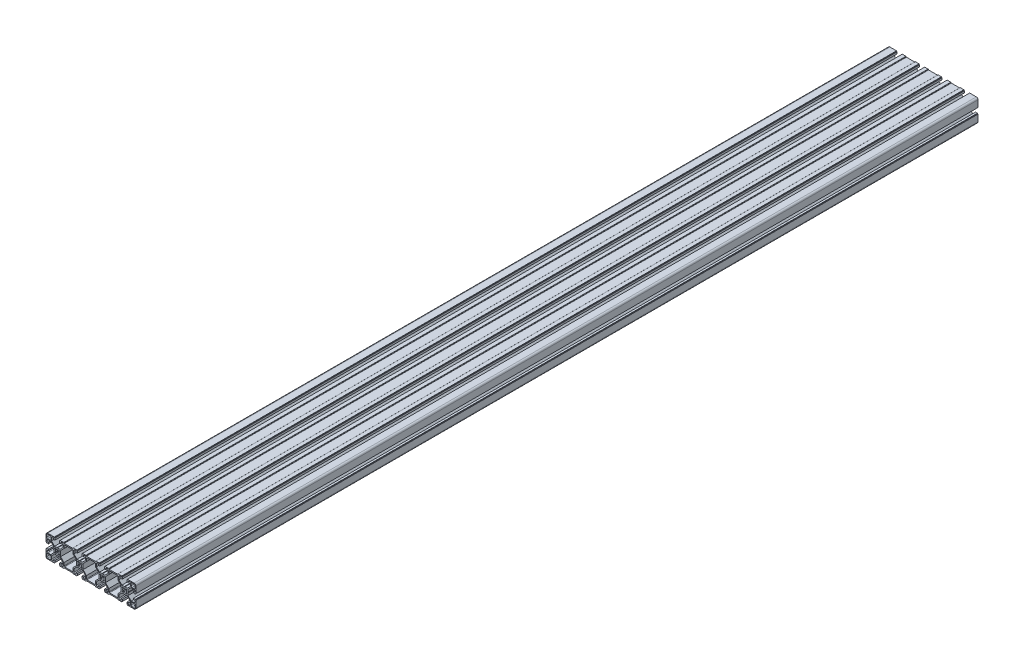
SolidWorks part; units mm, degrees
ref_plane "Спереди" through (0, 0, 0) normal (0, 0, 1) x (1, 0, 0)
ref_plane "Сверху" through (0, 0, 0) normal (0, 1, 0) x (1, 0, 0)
ref_plane "Справа" through (0, 0, 0) normal (1, 0, 0) x (0, 0, -1)
sketch "Эскиз1" plane through (0, 0, 0) normal (0, 0, 1) x (1, 0, 0)
  line L0 (-46.462, 18.2077) -> (-46.462, 18.1877)
  line L1 (-53.4116, 18.6977) -> (-46.952, 18.6977)
  line L2 (-53.4116, 18.6977) -> (-53.4116, 17.6977)
  line L3 (-53.4116, 17.6977) -> (-54.4116, 17.6977)
  line L4 (-54.4116, 17.6977) -> (-54.4116, 14.2977)
  line L5 (-54.4116, 14.2977) -> (-52.1116, 14.2977)
  line L6 (-52.1116, 14.2977) -> (-52.1116, 15.4977)
  line L7 (-50.6116, 16.9977) -> (-49.763, 16.9977)
  line L8 (-48.263, 15.4977) -> (-48.263, 10.2315)
  line L9 (-48.263, 10.2315) -> (-53.7946, 4.6937)
  line L10 (-58.0239, 4.6937) -> (-53.7946, 4.6937)
  line L11 (-58.5194, 4.1983) -> (-58.0239, 4.6937)
  line L12 (-58.5194, 4.1983) -> (-59.0148, 4.6937)
  line L13 (-63.2441, 4.6937) -> (-59.0148, 4.6937)
  line L14 (-68.7597, 10.2122) -> (-63.2441, 4.6937)
  line L15 (-68.7597, 15.4977) -> (-68.7597, 10.2122)
  line L16 (-66.4116, 16.9977) -> (-67.2597, 16.9977)
  line L17 (-64.9116, 14.2977) -> (-64.9116, 15.4977)
  line L18 (-62.6116, 14.2977) -> (-64.9116, 14.2977)
  line L19 (-62.6116, 17.6977) -> (-62.6116, 14.2977)
  line L20 (-63.6116, 17.6977) -> (-62.6116, 17.6977)
  line L21 (-63.6116, 18.6977) -> (-63.6116, 17.6977)
  line L22 (-75.5116, 18.6977) -> (-63.6116, 18.6977)
  line L23 (-78.5116, 15.6977) -> (-78.5116, 3.7977)
  line L24 (-78.5116, 3.7977) -> (-77.5116, 3.7977)
  line L25 (-77.5116, 3.7977) -> (-77.5116, 2.7977)
  line L26 (-77.5116, 2.7977) -> (-74.1116, 2.7977)
  line L27 (-74.1116, 2.7977) -> (-74.1116, 5.0903)
  line L28 (-74.1116, 5.0903) -> (-75.3116, 5.0903)
  line L29 (-76.8116, 6.5903) -> (-76.8116, 7.4383)
  line L30 (-75.3116, 8.9383) -> (-70.0385, 8.9383)
  line L31 (-70.0385, 8.9383) -> (-64.5116, 3.4121)
  line L32 (-64.5116, 3.4121) -> (-64.5116, -0.8055)
  line L33 (-64.0107, -1.3064) -> (-64.5116, -0.8055)
  line L34 (-64.0107, -1.3064) -> (-64.5116, -1.8073)
  line L35 (-64.5116, -1.8073) -> (-64.5116, -6.0248)
  line L36 (-64.5116, -6.0248) -> (-70.0391, -11.5523)
  line L37 (-75.3116, -11.5523) -> (-70.0391, -11.5523)
  line L38 (-76.8116, -9.2023) -> (-76.8116, -10.0523)
  line L39 (-74.1116, -7.7023) -> (-75.3116, -7.7023)
  line L40 (-74.1116, -5.4023) -> (-74.1116, -7.7023)
  line L41 (-77.5116, -5.4023) -> (-74.1116, -5.4023)
  line L42 (-77.5116, -6.4023) -> (-77.5116, -5.4023)
  line L43 (-78.5116, -6.4023) -> (-77.5116, -6.4023)
  line L44 (-78.5116, -6.4023) -> (-78.5116, -18.3023)
  line L45 (-63.6116, -21.3023) -> (-75.5116, -21.3023)
  line L46 (-63.6116, -21.3023) -> (-63.6116, -20.3023)
  line L47 (-63.6116, -20.3023) -> (-62.6116, -20.3023)
  line L48 (-62.6116, -20.3023) -> (-62.6116, -16.9023)
  line L49 (-62.6116, -16.9023) -> (-64.9116, -16.9023)
  line L50 (-64.9116, -16.9023) -> (-64.9116, -18.1023)
  line L51 (-66.4116, -19.6023) -> (-67.2616, -19.6023)
  line L52 (-68.7616, -18.1023) -> (-68.7616, -12.799)
  line L53 (-63.2494, -7.3063) -> (-68.7616, -12.799)
  line L54 (-63.2494, -7.3063) -> (-59.0181, -7.3063)
  line L55 (-58.5195, -6.8077) -> (-59.0181, -7.3063)
  line L56 (-58.5195, -6.8077) -> (-58.021, -7.3063)
  line L57 (-58.021, -7.3063) -> (-53.7897, -7.3063)
  line L58 (-53.7897, -7.3063) -> (-48.2666, -12.8248)
  line L59 (-48.2666, -18.1023) -> (-48.2666, -12.8248)
  line L60 (-50.6116, -19.6023) -> (-49.7666, -19.6023)
  line L61 (-52.1116, -16.9023) -> (-52.1116, -18.1023)
  line L62 (-54.4116, -16.9023) -> (-52.1116, -16.9023)
  line L63 (-54.4116, -20.3023) -> (-54.4116, -16.9023)
  line L64 (-53.4116, -20.3023) -> (-54.4116, -20.3023)
  line L65 (-53.4116, -21.3023) -> (-53.4116, -20.3023)
  line L66 (-53.4116, -21.3023) -> (-46.9623, -21.3023)
  line L67 (-46.4723, -20.8123) -> (-46.4723, -20.7923)
  line L68 (-45.9823, -20.3023) -> (-31.0574, -20.3023)
  line L69 (-30.5674, -20.8123) -> (-30.5674, -20.7923)
  line L70 (-30.0774, -21.3023) -> (-23.6116, -21.3023)
  line L71 (-23.6116, -21.3023) -> (-23.6116, -20.3023)
  line L72 (-23.6116, -20.3023) -> (-22.6116, -20.3023)
  line L73 (-22.6116, -20.3023) -> (-22.6116, -16.9023)
  line L74 (-22.6116, -16.9023) -> (-24.9116, -16.9023)
  line L75 (-24.9116, -16.9023) -> (-24.9116, -18.1023)
  line L76 (-26.4116, -19.6023) -> (-27.2616, -19.6023)
  line L77 (-28.7616, -18.1023) -> (-28.7616, -12.799)
  line L78 (-23.2494, -7.3063) -> (-28.7616, -12.799)
  line L79 (-23.2494, -7.3063) -> (-19.0181, -7.3063)
  line L80 (-18.5195, -6.8077) -> (-19.0181, -7.3063)
  line L81 (-18.5195, -6.8077) -> (-18.021, -7.3063)
  line L82 (-18.021, -7.3063) -> (-13.7897, -7.3063)
  line L83 (-13.7897, -7.3063) -> (-8.2666, -12.8248)
  line L84 (-8.2666, -18.1023) -> (-8.2666, -12.8248)
  line L85 (-10.6116, -19.6023) -> (-9.7666, -19.6023)
  line L86 (-12.1116, -16.9023) -> (-12.1116, -18.1023)
  line L87 (-14.4116, -16.9023) -> (-12.1116, -16.9023)
  line L88 (-14.4116, -20.3023) -> (-14.4116, -16.9023)
  line L89 (-13.4116, -20.3023) -> (-14.4116, -20.3023)
  line L90 (-13.4116, -21.3023) -> (-13.4116, -20.3023)
  line L91 (-7.4866, -21.3023) -> (-13.4116, -21.3023)
  line L92 (-6.9966, -20.8123) -> (-6.9966, -20.7923)
  line L93 (9.4784, -20.3023) -> (-6.5066, -20.3023)
  line L94 (9.9684, -20.8123) -> (9.9684, -20.7923)
  line L95 (16.3884, -21.3023) -> (10.4584, -21.3023)
  line L96 (16.3884, -21.3023) -> (16.3884, -20.3023)
  line L97 (16.3884, -20.3023) -> (17.3884, -20.3023)
  line L98 (17.3884, -20.3023) -> (17.3884, -16.9023)
  line L99 (17.3884, -16.9023) -> (15.0884, -16.9023)
  line L100 (15.0884, -16.9023) -> (15.0884, -18.1023)
  line L101 (13.5884, -19.6023) -> (12.7384, -19.6023)
  line L102 (11.2384, -18.1023) -> (11.2384, -12.799)
  line L103 (16.7506, -7.3063) -> (11.2384, -12.799)
  line L104 (16.7506, -7.3063) -> (20.9819, -7.3063)
  line L105 (21.4805, -6.8077) -> (20.9819, -7.3063)
  line L106 (21.4805, -6.8077) -> (21.979, -7.3063)
  line L107 (21.979, -7.3063) -> (26.2103, -7.3063)
  line L108 (26.2103, -7.3063) -> (31.7334, -12.8248)
  line L109 (31.7334, -18.1023) -> (31.7334, -12.8248)
  line L110 (29.3884, -19.6023) -> (30.2334, -19.6023)
  line L111 (27.8884, -16.9023) -> (27.8884, -18.1023)
  line L112 (25.5884, -16.9023) -> (27.8884, -16.9023)
  line L113 (25.5884, -20.3023) -> (25.5884, -16.9023)
  line L114 (26.5884, -20.3023) -> (25.5884, -20.3023)
  line L115 (26.5884, -21.3023) -> (26.5884, -20.3023)
  line L116 (26.5884, -21.3023) -> (33.0377, -21.3023)
  line L117 (33.5277, -20.8123) -> (33.5277, -20.7923)
  line L118 (48.9426, -20.3023) -> (34.0177, -20.3023)
  line L119 (49.4326, -20.8123) -> (49.4326, -20.7923)
  line L120 (49.9226, -21.3023) -> (56.3884, -21.3023)
  line L121 (56.3884, -21.3023) -> (56.3884, -20.3023)
  line L122 (56.3884, -20.3023) -> (57.3884, -20.3023)
  line L123 (57.3884, -20.3023) -> (57.3884, -16.9023)
  line L124 (57.3884, -16.9023) -> (55.0884, -16.9023)
  line L125 (55.0884, -16.9023) -> (55.0884, -18.1023)
  line L126 (53.5884, -19.6023) -> (52.7384, -19.6023)
  line L127 (51.2384, -18.1023) -> (51.2384, -12.799)
  line L128 (56.7506, -7.3063) -> (51.2384, -12.799)
  line L129 (56.7506, -7.3063) -> (60.9819, -7.3063)
  line L130 (61.4805, -6.8077) -> (60.9819, -7.3063)
  line L131 (61.4805, -6.8077) -> (61.979, -7.3063)
  line L132 (61.979, -7.3063) -> (66.2103, -7.3063)
  line L133 (66.2103, -7.3063) -> (71.7334, -12.8248)
  line L134 (71.7334, -18.1023) -> (71.7334, -12.8248)
  line L135 (69.3884, -19.6023) -> (70.2334, -19.6023)
  line L136 (67.8884, -16.9023) -> (67.8884, -18.1023)
  line L137 (65.5884, -16.9023) -> (67.8884, -16.9023)
  line L138 (65.5884, -20.3023) -> (65.5884, -16.9023)
  line L139 (66.5884, -20.3023) -> (65.5884, -20.3023)
  line L140 (66.5884, -21.3023) -> (66.5884, -20.3023)
  line L141 (78.4884, -21.3023) -> (66.5884, -21.3023)
  line L142 (81.4884, -6.4023) -> (81.4884, -18.3023)
  line L143 (81.4884, -6.4023) -> (80.4831, -6.4023)
  line L144 (80.4831, -6.4023) -> (80.4831, -5.4023)
  line L145 (80.4831, -5.4023) -> (77.0831, -5.4023)
  line L146 (77.0831, -5.4023) -> (77.0831, -7.7023)
  line L147 (77.0831, -7.7023) -> (78.2831, -7.7023)
  line L148 (79.7831, -9.2023) -> (79.7831, -10.0582)
  line L149 (78.2831, -11.5582) -> (73.0067, -11.5582)
  line L150 (67.4831, -6.0343) -> (73.0067, -11.5582)
  line L151 (67.4831, -1.7964) -> (67.4831, -6.0343)
  line L152 (66.9919, -1.3052) -> (67.4831, -1.7964)
  line L153 (66.9919, -1.3052) -> (67.4831, -0.814)
  line L154 (67.4831, 3.4238) -> (67.4831, -0.814)
  line L155 (73.0056, 8.9438) -> (67.4831, 3.4238)
  line L156 (78.2831, 8.9438) -> (73.0056, 8.9438)
  line L157 (79.7831, 6.5998) -> (79.7831, 7.4438)
  line L158 (77.0831, 5.0998) -> (78.2831, 5.0998)
  line L159 (77.0831, 2.7998) -> (77.0831, 5.0998)
  line L160 (80.4831, 2.7998) -> (77.0831, 2.7998)
  line L161 (80.4831, 3.7998) -> (80.4831, 2.7998)
  line L162 (81.4884, 3.7998) -> (80.4831, 3.7998)
  line L163 (81.4884, 15.6977) -> (81.4884, 3.7998)
  line L164 (66.5884, 18.6977) -> (78.4884, 18.6977)
  line L165 (66.5884, 18.6977) -> (66.5884, 17.6977)
  line L166 (66.5884, 17.6977) -> (65.5884, 17.6977)
  line L167 (65.5884, 17.6977) -> (65.5884, 14.2977)
  line L168 (65.5884, 14.2977) -> (67.8884, 14.2977)
  line L169 (67.8884, 14.2977) -> (67.8884, 15.4977)
  line L170 (69.3884, 16.9977) -> (70.237, 16.9977)
  line L171 (71.737, 15.4977) -> (71.737, 10.2315)
  line L172 (71.737, 10.2315) -> (66.2054, 4.6937)
  line L173 (61.9761, 4.6937) -> (66.2054, 4.6937)
  line L174 (61.4806, 4.1983) -> (61.9761, 4.6937)
  line L175 (61.4806, 4.1983) -> (60.9852, 4.6937)
  line L176 (56.7559, 4.6937) -> (60.9852, 4.6937)
  line L177 (51.2403, 10.2122) -> (56.7559, 4.6937)
  line L178 (51.2403, 15.4977) -> (51.2403, 10.2122)
  line L179 (53.5884, 16.9977) -> (52.7403, 16.9977)
  line L180 (55.0884, 14.2977) -> (55.0884, 15.4977)
  line L181 (57.3884, 14.2977) -> (55.0884, 14.2977)
  line L182 (57.3884, 17.6977) -> (57.3884, 14.2977)
  line L183 (56.3884, 17.6977) -> (57.3884, 17.6977)
  line L184 (56.3884, 18.6977) -> (56.3884, 17.6977)
  line L185 (49.9314, 18.6977) -> (56.3884, 18.6977)
  line L186 (49.4414, 18.2077) -> (49.4414, 18.1877)
  line L187 (48.9514, 17.6977) -> (34.028, 17.6977)
  line L188 (33.538, 18.2077) -> (33.538, 18.1877)
  line L189 (26.5884, 18.6977) -> (33.048, 18.6977)
  line L190 (26.5884, 18.6977) -> (26.5884, 17.6977)
  line L191 (26.5884, 17.6977) -> (25.5884, 17.6977)
  line L192 (25.5884, 17.6977) -> (25.5884, 14.2977)
  line L193 (25.5884, 14.2977) -> (27.8884, 14.2977)
  line L194 (27.8884, 14.2977) -> (27.8884, 15.4977)
  line L195 (29.3884, 16.9977) -> (30.237, 16.9977)
  line L196 (31.737, 15.4977) -> (31.737, 10.2315)
  line L197 (31.737, 10.2315) -> (26.2054, 4.6937)
  line L198 (21.9761, 4.6937) -> (26.2054, 4.6937)
  line L199 (21.4806, 4.1983) -> (21.9761, 4.6937)
  line L200 (21.4806, 4.1983) -> (20.9852, 4.6937)
  line L201 (16.7559, 4.6937) -> (20.9852, 4.6937)
  line L202 (11.2403, 10.2122) -> (16.7559, 4.6937)
  line L203 (11.2403, 15.4977) -> (11.2403, 10.2122)
  line L204 (13.5884, 16.9977) -> (12.7403, 16.9977)
  line L205 (15.0884, 14.2977) -> (15.0884, 15.4977)
  line L206 (17.3884, 14.2977) -> (15.0884, 14.2977)
  line L207 (17.3884, 17.6977) -> (17.3884, 14.2977)
  line L208 (16.3884, 17.6977) -> (17.3884, 17.6977)
  line L209 (16.3884, 18.6977) -> (16.3884, 17.6977)
  line L210 (16.3884, 18.6977) -> (10.4603, 18.6977)
  line L211 (9.9703, 18.2077) -> (9.9703, 18.1877)
  line L212 (9.4803, 17.6977) -> (-6.503, 17.6977)
  line L213 (-6.993, 18.2077) -> (-6.993, 18.1877)
  line L214 (-7.483, 18.6977) -> (-13.4116, 18.6977)
  line L215 (-13.4116, 18.6977) -> (-13.4116, 17.6977)
  line L216 (-13.4116, 17.6977) -> (-14.4116, 17.6977)
  line L217 (-14.4116, 17.6977) -> (-14.4116, 14.2977)
  line L218 (-14.4116, 14.2977) -> (-12.1116, 14.2977)
  line L219 (-12.1116, 14.2977) -> (-12.1116, 15.4977)
  line L220 (-10.6116, 16.9977) -> (-9.763, 16.9977)
  line L221 (-8.263, 15.4977) -> (-8.263, 10.2315)
  line L222 (-8.263, 10.2315) -> (-13.7946, 4.6937)
  line L223 (-18.0239, 4.6937) -> (-13.7946, 4.6937)
  line L224 (-18.5194, 4.1983) -> (-18.0239, 4.6937)
  line L225 (-18.5194, 4.1983) -> (-19.0148, 4.6937)
  line L226 (-23.2441, 4.6937) -> (-19.0148, 4.6937)
  line L227 (-28.7597, 10.2122) -> (-23.2441, 4.6937)
  line L228 (-28.7597, 15.4977) -> (-28.7597, 10.2122)
  line L229 (-26.4116, 16.9977) -> (-27.2597, 16.9977)
  line L230 (-24.9116, 14.2977) -> (-24.9116, 15.4977)
  line L231 (-22.6116, 14.2977) -> (-24.9116, 14.2977)
  line L232 (-22.6116, 17.6977) -> (-22.6116, 14.2977)
  line L233 (-23.6116, 17.6977) -> (-22.6116, 17.6977)
  line L234 (-23.6116, 18.6977) -> (-23.6116, 17.6977)
  line L235 (-30.0686, 18.6977) -> (-23.6116, 18.6977)
  line L236 (-30.5586, 18.2077) -> (-30.5586, 18.1877)
  line L237 (-31.0486, 17.6977) -> (-45.972, 17.6977)
  line L238 (-69.8551, 11.8457) -> (-69.8551, 15.6977)
  line L239 (-71.6551, 10.0457) -> (-75.507, 10.0457)
  line L240 (-77.307, 15.6977) -> (-77.307, 11.8457)
  line L241 (-75.507, 17.4977) -> (-71.6551, 17.4977)
  line L242 (74.641, -12.6582) -> (78.493, -12.6582)
  line L243 (80.293, -18.3023) -> (80.293, -14.4582)
  line L244 (78.493, -20.1023) -> (74.641, -20.1023)
  line L245 (72.841, -14.4582) -> (72.841, -18.3023)
  line L246 (78.493, 17.4977) -> (74.6449, 17.4977)
  line L247 (80.293, 15.6977) -> (80.293, 11.8418)
  line L248 (74.6449, 10.0418) -> (78.493, 10.0418)
  line L249 (72.8449, 11.8418) -> (72.8449, 15.6977)
  line L250 (8.4403, 15.6977) -> (-5.463, 15.6977)
  line L251 (9.4403, 9.4601) -> (9.4403, 14.6977)
  line L252 (15.4884, 3.4121) -> (9.4403, 9.4601)
  line L253 (15.4884, 3.4121) -> (15.4884, -6.0248)
  line L254 (15.4884, -6.0248) -> (9.4384, -12.0748)
  line L255 (9.4384, -17.3023) -> (9.4384, -12.0748)
  line L256 (8.4384, -18.3023) -> (-5.4666, -18.3023)
  line L257 (-6.4666, -12.0846) -> (-6.4666, -17.3023)
  line L258 (-12.5169, -6.0343) -> (-6.4666, -12.0846)
  line L259 (-12.5169, 3.4238) -> (-12.5169, -6.0343)
  line L260 (-12.5169, 3.4238) -> (-6.463, 9.4777)
  line L261 (-6.463, 14.6977) -> (-6.463, 9.4777)
  line L262 (34.538, 15.6977) -> (48.4414, 15.6977)
  line L263 (49.4414, 14.6977) -> (49.4414, 9.4241)
  line L264 (49.4414, 9.4241) -> (55.454, 3.4121)
  line L265 (55.454, 3.4121) -> (55.4531, -6.0248)
  line L266 (55.4531, -6.0248) -> (49.4326, -12.0453)
  line L267 (49.4326, -12.0453) -> (49.4326, -17.3023)
  line L268 (34.5277, -18.3023) -> (48.4326, -18.3023)
  line L269 (33.5277, -12.0792) -> (33.5277, -17.3023)
  line L270 (27.4831, -6.0343) -> (33.5277, -12.0792)
  line L271 (27.4831, 3.4238) -> (27.4831, -6.0343)
  line L272 (33.538, 9.4763) -> (27.4831, 3.4238)
  line L273 (33.538, 14.6977) -> (33.538, 9.4763)
  line L274 (25.5588, -4.665) -> (24.8517, -5.3721)
  line L275 (23.0837, -4.3112) -> (24.1446, -5.3721)
  line L276 (19.9022, -4.3112) -> (18.8413, -5.3721)
  line L277 (17.4271, -4.665) -> (18.1342, -5.3721)
  line L278 (18.488, -2.897) -> (17.4271, -3.9579)
  line L279 (17.4271, 1.3454) -> (18.488, 0.2845)
  line L280 (18.1342, 2.7596) -> (17.4271, 2.0525)
  line L281 (18.8413, 2.7596) -> (19.9022, 1.6987)
  line L282 (24.1446, 2.7596) -> (23.0837, 1.6987)
  line L283 (25.5588, 2.0525) -> (24.8517, 2.7596)
  line L284 (25.5588, 1.3454) -> (24.4979, 0.2845)
  line L285 (24.4979, -2.897) -> (25.5588, -3.9579)
  line L286 (-20.0978, -4.3112) -> (-21.1587, -5.3721)
  line L287 (-22.5729, -4.665) -> (-21.8658, -5.3721)
  line L288 (-21.512, -2.897) -> (-22.5729, -3.9579)
  line L289 (-22.5729, 1.3454) -> (-21.512, 0.2845)
  line L290 (-21.8658, 2.7596) -> (-22.5729, 2.0525)
  line L291 (-21.1587, 2.7596) -> (-20.0978, 1.6987)
  line L292 (-15.8554, 2.7596) -> (-16.9163, 1.6987)
  line L293 (-14.4412, 2.0525) -> (-15.1483, 2.7596)
  line L294 (-14.4412, 1.3454) -> (-15.5021, 0.2845)
  line L295 (-15.5021, -2.897) -> (-14.4412, -3.9579)
  line L296 (-15.1483, -5.3721) -> (-14.4412, -4.665)
  line L297 (-16.9163, -4.3112) -> (-15.8554, -5.3721)
  line L298 (-55.8554, 2.7596) -> (-56.9163, 1.6987)
  line L299 (-54.4412, 2.0525) -> (-55.1483, 2.7596)
  line L300 (-54.4412, 1.3454) -> (-55.5021, 0.2845)
  line L301 (-55.5021, -2.897) -> (-54.4412, -3.9579)
  line L302 (-55.1483, -5.3721) -> (-54.4412, -4.665)
  line L303 (-56.9163, -4.3112) -> (-55.8554, -5.3721)
  line L304 (-60.0978, -4.3112) -> (-61.1587, -5.3721)
  line L305 (-62.5729, -4.665) -> (-61.8658, -5.3721)
  line L306 (-61.512, -2.897) -> (-62.5729, -3.9579)
  line L307 (-62.5729, 1.3454) -> (-61.512, 0.2845)
  line L308 (-61.8658, 2.7596) -> (-62.5729, 2.0525)
  line L309 (-61.1587, 2.7596) -> (-60.0978, 1.6987)
  line L310 (64.8517, -5.3721) -> (65.5588, -4.665)
  line L311 (63.0837, -4.3112) -> (64.1446, -5.3721)
  line L312 (59.9022, -4.3112) -> (58.8413, -5.3721)
  line L313 (57.4271, -4.665) -> (58.1342, -5.3721)
  line L314 (58.488, -2.897) -> (57.4271, -3.9579)
  line L315 (57.4271, 1.3454) -> (58.488, 0.2845)
  line L316 (58.1342, 2.7596) -> (57.4271, 2.0525)
  line L317 (58.8413, 2.7596) -> (59.9022, 1.6987)
  line L318 (64.1446, 2.7596) -> (63.0837, 1.6987)
  line L319 (65.5588, 2.0525) -> (64.8517, 2.7596)
  line L320 (65.5588, 1.3454) -> (64.4979, 0.2845)
  line L321 (64.4979, -2.897) -> (65.5588, -3.9579)
  line L322 (-45.4723, -18.3023) -> (-31.5674, -18.3023)
  line L323 (-46.4723, -12.0792) -> (-46.4723, -17.3023)
  line L324 (-52.5169, -6.0343) -> (-46.4723, -12.0792)
  line L325 (-52.5169, 3.4238) -> (-52.5169, -6.0343)
  line L326 (-46.462, 9.4763) -> (-52.5169, 3.4238)
  line L327 (-46.462, 14.6977) -> (-46.462, 9.4763)
  line L328 (-45.462, 15.6977) -> (-31.5586, 15.6977)
  line L329 (-30.5586, 14.6977) -> (-30.5586, 9.4241)
  line L330 (-30.5586, 9.4241) -> (-24.546, 3.4121)
  line L331 (-24.546, 3.4121) -> (-24.5469, -6.0248)
  line L332 (-24.5469, -6.0248) -> (-30.5674, -12.0453)
  line L333 (-30.5674, -12.0453) -> (-30.5674, -17.3023)
  line L334 (-77.307, -18.3023) -> (-77.307, -14.4523)
  line L335 (-71.657, -12.6523) -> (-75.507, -12.6523)
  line L336 (-69.857, -14.4523) -> (-69.857, -18.3023)
  line L337 (-75.507, -20.1023) -> (-71.657, -20.1023)
  arc A0 (-46.462, 18.2077) -> (-46.952, 18.6977) centre (-46.952, 18.2077) ccw
  arc A1 (-50.6116, 16.9977) -> (-52.1116, 15.4977) centre (-50.6116, 15.4977) ccw
  arc A2 (-48.263, 15.4977) -> (-49.763, 16.9977) centre (-49.763, 15.4977) ccw
  arc A3 (-67.2597, 16.9977) -> (-68.7597, 15.4977) centre (-67.2597, 15.4977) ccw
  arc A4 (-64.9116, 15.4977) -> (-66.4116, 16.9977) centre (-66.4116, 15.4977) ccw
  arc A5 (-75.5116, 18.6977) -> (-78.5116, 15.6977) centre (-75.5116, 15.6977) ccw
  arc A6 (-76.8116, 6.5903) -> (-75.3116, 5.0903) centre (-75.3116, 6.5903) ccw
  arc A7 (-75.3116, 8.9383) -> (-76.8116, 7.4383) centre (-75.3116, 7.4383) ccw
  arc A8 (-76.8116, -10.0523) -> (-75.3116, -11.5523) centre (-75.3116, -10.0523) ccw
  arc A9 (-75.3116, -7.7023) -> (-76.8116, -9.2023) centre (-75.3116, -9.2023) ccw
  arc A10 (-78.5116, -18.3023) -> (-75.5116, -21.3023) centre (-75.5116, -18.3023) ccw
  arc A11 (-66.4116, -19.6023) -> (-64.9116, -18.1023) centre (-66.4116, -18.1023) ccw
  arc A12 (-68.7616, -18.1023) -> (-67.2616, -19.6023) centre (-67.2616, -18.1023) ccw
  arc A13 (-49.7666, -19.6023) -> (-48.2666, -18.1023) centre (-49.7666, -18.1023) ccw
  arc A14 (-52.1116, -18.1023) -> (-50.6116, -19.6023) centre (-50.6116, -18.1023) ccw
  arc A15 (-46.9623, -21.3023) -> (-46.4723, -20.8123) centre (-46.9623, -20.8123) ccw
  arc A16 (-45.9823, -20.3023) -> (-46.4723, -20.7923) centre (-45.9823, -20.7923) ccw
  arc A17 (-30.5674, -20.7923) -> (-31.0574, -20.3023) centre (-31.0574, -20.7923) ccw
  arc A18 (-30.5674, -20.8123) -> (-30.0774, -21.3023) centre (-30.0774, -20.8123) ccw
  arc A19 (-26.4116, -19.6023) -> (-24.9116, -18.1023) centre (-26.4116, -18.1023) ccw
  arc A20 (-28.7616, -18.1023) -> (-27.2616, -19.6023) centre (-27.2616, -18.1023) ccw
  arc A21 (-9.7666, -19.6023) -> (-8.2666, -18.1023) centre (-9.7666, -18.1023) ccw
  arc A22 (-12.1116, -18.1023) -> (-10.6116, -19.6023) centre (-10.6116, -18.1023) ccw
  arc A23 (-7.4866, -21.3023) -> (-6.9966, -20.8123) centre (-7.4866, -20.8123) ccw
  arc A24 (-6.5066, -20.3023) -> (-6.9966, -20.7923) centre (-6.5066, -20.7923) ccw
  arc A25 (9.9684, -20.7923) -> (9.4784, -20.3023) centre (9.4784, -20.7923) ccw
  arc A26 (9.9684, -20.8123) -> (10.4584, -21.3023) centre (10.4584, -20.8123) ccw
  arc A27 (13.5884, -19.6023) -> (15.0884, -18.1023) centre (13.5884, -18.1023) ccw
  arc A28 (11.2384, -18.1023) -> (12.7384, -19.6023) centre (12.7384, -18.1023) ccw
  arc A29 (30.2334, -19.6023) -> (31.7334, -18.1023) centre (30.2334, -18.1023) ccw
  arc A30 (27.8884, -18.1023) -> (29.3884, -19.6023) centre (29.3884, -18.1023) ccw
  arc A31 (33.0377, -21.3023) -> (33.5277, -20.8123) centre (33.0377, -20.8123) ccw
  arc A32 (34.0177, -20.3023) -> (33.5277, -20.7923) centre (34.0177, -20.7923) ccw
  arc A33 (49.4326, -20.7923) -> (48.9426, -20.3023) centre (48.9426, -20.7923) ccw
  arc A34 (49.4326, -20.8123) -> (49.9226, -21.3023) centre (49.9226, -20.8123) ccw
  arc A35 (53.5884, -19.6023) -> (55.0884, -18.1023) centre (53.5884, -18.1023) ccw
  arc A36 (51.2384, -18.1023) -> (52.7384, -19.6023) centre (52.7384, -18.1023) ccw
  arc A37 (70.2334, -19.6023) -> (71.7334, -18.1023) centre (70.2334, -18.1023) ccw
  arc A38 (67.8884, -18.1023) -> (69.3884, -19.6023) centre (69.3884, -18.1023) ccw
  arc A39 (78.4884, -21.3023) -> (81.4884, -18.3023) centre (78.4884, -18.3023) ccw
  arc A40 (79.7831, -9.2023) -> (78.2831, -7.7023) centre (78.2831, -9.2023) ccw
  arc A41 (78.2831, -11.5582) -> (79.7831, -10.0582) centre (78.2831, -10.0582) ccw
  arc A42 (79.7831, 7.4438) -> (78.2831, 8.9438) centre (78.2831, 7.4438) ccw
  arc A43 (78.2831, 5.0998) -> (79.7831, 6.5998) centre (78.2831, 6.5998) ccw
  arc A44 (81.4884, 15.6977) -> (78.4884, 18.6977) centre (78.4884, 15.6977) ccw
  arc A45 (69.3884, 16.9977) -> (67.8884, 15.4977) centre (69.3884, 15.4977) ccw
  arc A46 (71.737, 15.4977) -> (70.237, 16.9977) centre (70.237, 15.4977) ccw
  arc A47 (52.7403, 16.9977) -> (51.2403, 15.4977) centre (52.7403, 15.4977) ccw
  arc A48 (55.0884, 15.4977) -> (53.5884, 16.9977) centre (53.5884, 15.4977) ccw
  arc A49 (49.9314, 18.6977) -> (49.4414, 18.2077) centre (49.9314, 18.2077) ccw
  arc A50 (48.9514, 17.6977) -> (49.4414, 18.1877) centre (48.9514, 18.1877) ccw
  arc A51 (33.538, 18.1877) -> (34.028, 17.6977) centre (34.028, 18.1877) ccw
  arc A52 (33.538, 18.2077) -> (33.048, 18.6977) centre (33.048, 18.2077) ccw
  arc A53 (29.3884, 16.9977) -> (27.8884, 15.4977) centre (29.3884, 15.4977) ccw
  arc A54 (31.737, 15.4977) -> (30.237, 16.9977) centre (30.237, 15.4977) ccw
  arc A55 (12.7403, 16.9977) -> (11.2403, 15.4977) centre (12.7403, 15.4977) ccw
  arc A56 (15.0884, 15.4977) -> (13.5884, 16.9977) centre (13.5884, 15.4977) ccw
  arc A57 (10.4603, 18.6977) -> (9.9703, 18.2077) centre (10.4603, 18.2077) ccw
  arc A58 (9.4803, 17.6977) -> (9.9703, 18.1877) centre (9.4803, 18.1877) ccw
  arc A59 (-6.993, 18.1877) -> (-6.503, 17.6977) centre (-6.503, 18.1877) ccw
  arc A60 (-6.993, 18.2077) -> (-7.483, 18.6977) centre (-7.483, 18.2077) ccw
  arc A61 (-10.6116, 16.9977) -> (-12.1116, 15.4977) centre (-10.6116, 15.4977) ccw
  arc A62 (-8.263, 15.4977) -> (-9.763, 16.9977) centre (-9.763, 15.4977) ccw
  arc A63 (-27.2597, 16.9977) -> (-28.7597, 15.4977) centre (-27.2597, 15.4977) ccw
  arc A64 (-24.9116, 15.4977) -> (-26.4116, 16.9977) centre (-26.4116, 15.4977) ccw
  arc A65 (-30.0686, 18.6977) -> (-30.5586, 18.2077) centre (-30.0686, 18.2077) ccw
  arc A66 (-31.0486, 17.6977) -> (-30.5586, 18.1877) centre (-31.0486, 18.1877) ccw
  arc A67 (-46.462, 18.1877) -> (-45.972, 17.6977) centre (-45.972, 18.1877) ccw
  arc A68 (-69.8551, 15.6977) -> (-71.6551, 17.4977) centre (-71.6551, 15.6977) ccw
  arc A69 (-71.6551, 10.0457) -> (-69.8551, 11.8457) centre (-71.6551, 11.8457) ccw
  arc A70 (-77.307, 11.8457) -> (-75.507, 10.0457) centre (-75.507, 11.8457) ccw
  arc A71 (-75.507, 17.4977) -> (-77.307, 15.6977) centre (-75.507, 15.6977) ccw
  arc A72 (80.293, -14.4582) -> (78.493, -12.6582) centre (78.493, -14.4582) ccw
  arc A73 (78.493, -20.1023) -> (80.293, -18.3023) centre (78.493, -18.3023) ccw
  arc A74 (72.841, -18.3023) -> (74.641, -20.1023) centre (74.641, -18.3023) ccw
  arc A75 (74.641, -12.6582) -> (72.841, -14.4582) centre (74.641, -14.4582) ccw
  arc A76 (74.6449, 17.4977) -> (72.8449, 15.6977) centre (74.6449, 15.6977) ccw
  arc A77 (80.293, 15.6977) -> (78.493, 17.4977) centre (78.493, 15.6977) ccw
  arc A78 (78.493, 10.0418) -> (80.293, 11.8418) centre (78.493, 11.8418) ccw
  arc A79 (72.8449, 11.8418) -> (74.6449, 10.0418) centre (74.6449, 11.8418) ccw
  arc A80 (9.4403, 14.6977) -> (8.4403, 15.6977) centre (8.4403, 14.6977) ccw
  arc A81 (8.4384, -18.3023) -> (9.4384, -17.3023) centre (8.4384, -17.3023) ccw
  arc A82 (-6.4666, -17.3023) -> (-5.4666, -18.3023) centre (-5.4666, -17.3023) ccw
  arc A83 (-5.463, 15.6977) -> (-6.463, 14.6977) centre (-5.463, 14.6977) ccw
  arc A84 (34.538, 15.6977) -> (33.538, 14.6977) centre (34.538, 14.6977) ccw
  arc A85 (49.4414, 14.6977) -> (48.4414, 15.6977) centre (48.4414, 14.6977) ccw
  arc A86 (48.4326, -18.3023) -> (49.4326, -17.3023) centre (48.4326, -17.3023) ccw
  arc A87 (33.5277, -17.3023) -> (34.5277, -18.3023) centre (34.5277, -17.3023) ccw
  arc A88 (24.1446, -5.3721) -> (24.8517, -5.3721) centre (24.4982, -5.0186) ccw
  arc A89 (19.9022, -4.3112) -> (23.0837, -4.3112) centre (21.493, -1.3063) ccw
  arc A90 (18.1342, -5.3721) -> (18.8413, -5.3721) centre (18.4878, -5.0186) ccw
  arc A91 (17.4271, -3.9579) -> (17.4271, -4.665) centre (17.7807, -4.3115) ccw
  arc A92 (18.488, 0.2845) -> (18.488, -2.897) centre (21.493, -1.3063) ccw
  arc A93 (17.4271, 2.0525) -> (17.4271, 1.3454) centre (17.7807, 1.6989) ccw
  arc A94 (18.8413, 2.7596) -> (18.1342, 2.7596) centre (18.4878, 2.406) ccw
  arc A95 (23.0837, 1.6987) -> (19.9022, 1.6987) centre (21.493, -1.3063) ccw
  arc A96 (24.8517, 2.7596) -> (24.1446, 2.7596) centre (24.4982, 2.406) ccw
  arc A97 (25.5588, 1.3454) -> (25.5588, 2.0525) centre (25.2053, 1.6989) ccw
  arc A98 (24.4979, -2.897) -> (24.4979, 0.2845) centre (21.493, -1.3063) ccw
  arc A99 (25.5588, -4.665) -> (25.5588, -3.9579) centre (25.2053, -4.3115) ccw
  arc A100 (-20.0978, -4.3112) -> (-16.9163, -4.3112) centre (-18.507, -1.3063) ccw
  arc A101 (-21.8658, -5.3721) -> (-21.1587, -5.3721) centre (-21.5122, -5.0186) ccw
  arc A102 (-22.5729, -3.9579) -> (-22.5729, -4.665) centre (-22.2193, -4.3115) ccw
  arc A103 (-21.512, 0.2845) -> (-21.512, -2.897) centre (-18.507, -1.3063) ccw
  arc A104 (-22.5729, 2.0525) -> (-22.5729, 1.3454) centre (-22.2193, 1.6989) ccw
  arc A105 (-21.1587, 2.7596) -> (-21.8658, 2.7596) centre (-21.5122, 2.406) ccw
  arc A106 (-16.9163, 1.6987) -> (-20.0978, 1.6987) centre (-18.507, -1.3063) ccw
  arc A107 (-15.1483, 2.7596) -> (-15.8554, 2.7596) centre (-15.5018, 2.406) ccw
  arc A108 (-14.4412, 1.3454) -> (-14.4412, 2.0525) centre (-14.7947, 1.6989) ccw
  arc A109 (-15.5021, -2.897) -> (-15.5021, 0.2845) centre (-18.507, -1.3063) ccw
  arc A110 (-14.4412, -4.665) -> (-14.4412, -3.9579) centre (-14.7947, -4.3115) ccw
  arc A111 (-15.8554, -5.3721) -> (-15.1483, -5.3721) centre (-15.5018, -5.0186) ccw
  arc A112 (-56.9163, 1.6987) -> (-60.0978, 1.6987) centre (-58.507, -1.3063) ccw
  arc A113 (-55.1483, 2.7596) -> (-55.8554, 2.7596) centre (-55.5018, 2.406) ccw
  arc A114 (-54.4412, 1.3454) -> (-54.4412, 2.0525) centre (-54.7947, 1.6989) ccw
  arc A115 (-55.5021, -2.897) -> (-55.5021, 0.2845) centre (-58.507, -1.3063) ccw
  arc A116 (-54.4412, -4.665) -> (-54.4412, -3.9579) centre (-54.7947, -4.3115) ccw
  arc A117 (-55.8554, -5.3721) -> (-55.1483, -5.3721) centre (-55.5018, -5.0186) ccw
  arc A118 (-60.0978, -4.3112) -> (-56.9163, -4.3112) centre (-58.507, -1.3063) ccw
  arc A119 (-61.8658, -5.3721) -> (-61.1587, -5.3721) centre (-61.5122, -5.0186) ccw
  arc A120 (-62.5729, -3.9579) -> (-62.5729, -4.665) centre (-62.2193, -4.3115) ccw
  arc A121 (-61.512, 0.2845) -> (-61.512, -2.897) centre (-58.507, -1.3063) ccw
  arc A122 (-62.5729, 2.0525) -> (-62.5729, 1.3454) centre (-62.2193, 1.6989) ccw
  arc A123 (-61.1587, 2.7596) -> (-61.8658, 2.7596) centre (-61.5122, 2.406) ccw
  arc A124 (65.5588, -4.665) -> (65.5588, -3.9579) centre (65.2053, -4.3115) ccw
  arc A125 (64.1446, -5.3721) -> (64.8517, -5.3721) centre (64.4982, -5.0186) ccw
  arc A126 (59.9022, -4.3112) -> (63.0837, -4.3112) centre (61.493, -1.3063) ccw
  arc A127 (58.1342, -5.3721) -> (58.8413, -5.3721) centre (58.4878, -5.0186) ccw
  arc A128 (57.4271, -3.9579) -> (57.4271, -4.665) centre (57.7807, -4.3115) ccw
  arc A129 (58.488, 0.2845) -> (58.488, -2.897) centre (61.493, -1.3063) ccw
  arc A130 (57.4271, 2.0525) -> (57.4271, 1.3454) centre (57.7807, 1.6989) ccw
  arc A131 (58.8413, 2.7596) -> (58.1342, 2.7596) centre (58.4878, 2.406) ccw
  arc A132 (63.0837, 1.6987) -> (59.9022, 1.6987) centre (61.493, -1.3063) ccw
  arc A133 (64.8517, 2.7596) -> (64.1446, 2.7596) centre (64.4982, 2.406) ccw
  arc A134 (65.5588, 1.3454) -> (65.5588, 2.0525) centre (65.2053, 1.6989) ccw
  arc A135 (64.4979, -2.897) -> (64.4979, 0.2845) centre (61.493, -1.3063) ccw
  arc A136 (-46.4723, -17.3023) -> (-45.4723, -18.3023) centre (-45.4723, -17.3023) ccw
  arc A137 (-45.462, 15.6977) -> (-46.462, 14.6977) centre (-45.462, 14.6977) ccw
  arc A138 (-30.5586, 14.6977) -> (-31.5586, 15.6977) centre (-31.5586, 14.6977) ccw
  arc A139 (-31.5674, -18.3023) -> (-30.5674, -17.3023) centre (-31.5674, -17.3023) ccw
  arc A140 (-75.507, -12.6523) -> (-77.307, -14.4523) centre (-75.507, -14.4523) ccw
  arc A141 (-69.857, -14.4523) -> (-71.657, -12.6523) centre (-71.657, -14.4523) ccw
  arc A142 (-71.657, -20.1023) -> (-69.857, -18.3023) centre (-71.657, -18.3023) ccw
  arc A143 (-77.307, -18.3023) -> (-75.507, -20.1023) centre (-75.507, -18.3023) ccw
extrude "Бобышка-Вытянуть1" add sketch "Эскиз1" along normal blind 1500
hole_wizard "Диаметр отверстия Ø8.2 (8.2)2" positions "Эскиз4" profile "Эскиз5" hole size "Ø8.2" standard "ISO"
sketch "Эскиз4" plane through (0, 4.6937, 0) normal (0, 1, 0) x (1, 0, 0)
  line L1 (21.4806, -810) -> (21.4806, 0) construction
  line L2 (48.9514, -810) -> (34.028, -810) construction
  line L4 (61.4806, -810) -> (61.4806, 0) construction
  line L5 (66.2054, 0) -> (61.9761, 0) construction
  point P0 (21.4806, -780)
  point P11 (21.4806, -650)
  point P21 (21.4806, -630)
  point P22 (21.4806, -500)
  point P23 (21.4806, -480)
  point P24 (21.4806, -350)
  point P25 (21.4806, -330)
  point P26 (21.4806, -200)
  point P27 (21.4806, -180)
  point P28 (21.4806, -50)
  point P33 (61.4806, -20)
  point P43 (21.4806, -20)
  point P44 (-18.5194, -20)
  point P45 (-58.5194, -20)
  dimension "D1" = 30
  dimension "D2" = 130
  dimension "D5" = 20
  dimension "D3" = 5
  dimension "D4" = 4
sketch "Эскиз5" plane through (21.4806, 4.6937, 780) normal (1, 0, 0) x (0, 0, 1)
  line L0 (0, 0) -> (0, 28.6635)
  line L1 (0, 28.6635) -> (4.1, 26.2)
  line L2 (4.1, 26.2) -> (4.1, 0)
  line L5 (4.1, 0) -> (0, 0)
  line L10 (0, 28.6635) -> (-4.1, 26.2) construction
  line L11 (0, -6.35) -> (0, 107.95) construction
  dimension "Диаметр отверстия" = 8.2
  dimension "Глубина отверстия" = 26.2
  dimension "Угол заточки сверла" = 118
